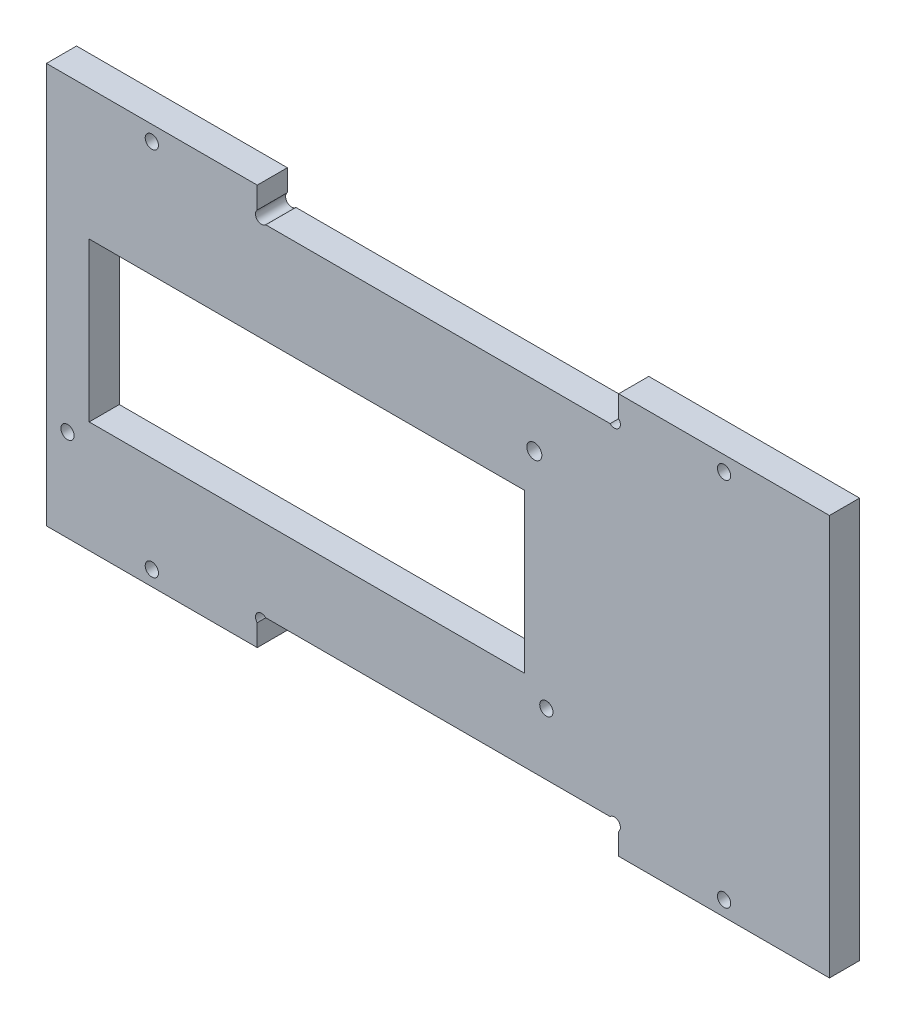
SolidWorks part; units mm, degrees
ref_plane "Plan de face" through (0, 0, 0) normal (0, 0, 1) x (1, 0, 0)
ref_plane "Plan de dessus" through (0, 0, 0) normal (0, 1, 0) x (1, 0, 0)
ref_plane "Plan de droite" through (0, 0, 0) normal (1, 0, 0) x (0, 0, -1)
sketch "Esquisse1" plane through (0, 0, 0) normal (0, 0, 1) x (1, 0, 0)
  line L1 (0, 0) -> (130, 0)
  line L2 (0, 0) -> (0, 66.5)
  line L3 (0, 66.5) -> (130, 66.5)
  line L4 (130, 0) -> (130, 66.5)
  dimension "D1" = 130
  dimension "D2" = 66.5
extrude "Boss.-Extru.1" add sketch "Esquisse1" along normal blind 5
sketch "Esquisse2" plane through (0, 0, 5) normal (0, 0, 1) x (1, 0, 0)
  line L0 (0, 66.5) -> (0, 0) construction
  line L1 (130, 66.5) -> (0, 66.5) construction
  line L2 (83, 15.25) -> (3.5, 15.25) construction
  line L3 (5.5, 51.25) -> (81, 51.25) construction
  circle A0 centre (81, 51.25) radius 1.25
  circle A2 centre (83, 15.25) radius 1.1
  circle A3 centre (3.5, 15.25) radius 1.1
  point P2 (5.5, 51.25)
  dimension "D1" = 2.5
  dimension "D2" = 79.5
  dimension "D6" = 2.2
  dimension "D7" = 2.2
  dimension "D3" = 36
  dimension "D4" = 81
  dimension "D5" = 15.25
  dimension "D8" = 75.5
  dimension "D9" = 3.5
extrude "Enlèv. mat.-Extru.1" cut sketch "Esquisse2" against normal up to next
sketch "Esquisse3" plane through (0, 0, 5) normal (0, 0, 1) x (1, 0, 0)
  line L1 (79.4, 18.5) -> (7.1, 18.5)
  line L2 (79.4, 18.5) -> (79.4, 44.8)
  line L3 (79.4, 44.8) -> (7.1, 44.8)
  line L4 (7.1, 18.5) -> (7.1, 44.8)
  circle A1 centre (81, 51.25) radius 1.25 construction
  dimension "D3" = 1.6
  dimension "D1" = 26.3
  dimension "D2" = 72.3
  dimension "D4" = 6.45
extrude "Enlèv. mat.-Extru.2" cut sketch "Esquisse3" against normal up to next
sketch "Esquisse5" plane through (0, 0, 5) normal (0, 0, 1) x (1, 0, 0)
  circle A0 centre (83, 15.25) radius 2
  circle A1 centre (81, 51.25) radius 2
  circle A2 centre (3.5, 15.25) radius 2
  dimension "D1" = 4
  dimension "D2" = 4
  dimension "D3" = 4
extrude "Enlèv. mat.-Extru.3" [suppressed] cut sketch "Esquisse5" against normal blind 1.5
sketch "Esquisse6" plane through (0, 0, 5) normal (0, 0, 1) x (1, 0, 0)
  line L0 (0, 0) -> (130, 0) construction
  line L1 (95, 0) -> (35, 0)
  line L2 (95, 0) -> (95, 5)
  line L3 (95, 5) -> (35, 5)
  line L4 (35, 0) -> (35, 5)
  line L5 (130, 66.5) -> (0, 66.5) construction
  line L6 (95, 66.5) -> (35, 66.5)
  line L7 (95, 66.5) -> (95, 61.5)
  line L8 (95, 61.5) -> (35, 61.5)
  line L9 (35, 66.5) -> (35, 61.5)
  line L10 (130, 0) -> (130, 66.5) construction
  dimension "D1" = 5
  dimension "D2" = 5
  dimension "D3" = 60
  dimension "D4" = 60
  dimension "D5" = 35
  dimension "D6" = 35
extrude "Enlèv. mat.-Extru.4" cut sketch "Esquisse6" against normal up to next
sketch "Esquisse7" plane through (0, 0, 5) normal (0, 0, 1) x (1, 0, 0)
  line L0 (35, 5) -> (53.0632, -13.0632) construction
  line L1 (95, 5) -> (72.5313, -17.4687) construction
  line L2 (35, 61.5) -> (56.3913, 82.8913) construction
  line L3 (95, 61.5) -> (70.0123, 86.4877) construction
  line L4 (95, 5) -> (35, 5) construction
  line L5 (35, 61.5) -> (95, 61.5) construction
  circle A0 centre (94.2929, 4.2929) radius 1
  circle A1 centre (35.7071, 4.2929) radius 1
  circle A2 centre (35.7071, 62.2071) radius 1
  circle A3 centre (94.2929, 62.2071) radius 1
  dimension "D5" = 2
  dimension "D6" = 2
  dimension "D7" = 2
  dimension "D8" = 2
  dimension "D1" = 45
  dimension "D2" = 45
  dimension "D3" = 45
  dimension "D4" = 45
extrude "Enlèv. mat.-Extru.5" cut sketch "Esquisse7" against normal up to next
ref_plane "Plan1" through (65, 0, 0) normal (1, 0, 0) x (0, 0, -1)
ref_plane "Plan2" through (0, 33.25, 0) normal (0, 1, 0) x (-1, 0, 0)
sketch "Esquisse8" plane through (0, 0, 5) normal (0, 0, 1) x (1, 0, 0)
  line L0 (0, 0) -> (35, 0) construction
  line L1 (17.5, 0) -> (17.5, 12.6912) construction
  circle A0 centre (17.5, 2.5) radius 1.1
  dimension "D2" = 2.2
  dimension "D1" = 2.5
extrude "Enlèv. mat.-Extru.6" cut sketch "Esquisse8" against normal up to next
mirror "Symétrie1" about plane through (65, 0, 0) normal (1, 0, 0) of "Enlèv. mat.-Extru.6"
mirror "Symétrie2" about plane through (0, 33.25, 0) normal (0, 1, 0) of "Symétrie1", "Enlèv. mat.-Extru.6"
sketch "Esquisse10" plane through (0, 0, 0) normal (0, 0, -1) x (-1, 0, 0)
  line L0 (-79.4, 18.5) -> (-79.4, 44.8) construction
  line L1 (-78.4, 48.3) -> (-38.4, 48.3)
  line L2 (-78.4, 48.3) -> (-78.4, 54.8)
  line L3 (-78.4, 54.8) -> (-38.4, 54.8)
  line L4 (-38.4, 48.3) -> (-38.4, 54.8)
  line L5 (-79.4, 44.8) -> (-7.1, 44.8) construction
  dimension "D1" = 40
  dimension "D2" = 6.5
  dimension "D3" = 1
  dimension "D4" = 3.5
extrude "Enlèv. mat.-Extru.7" cut sketch "Esquisse10" against normal blind 1
